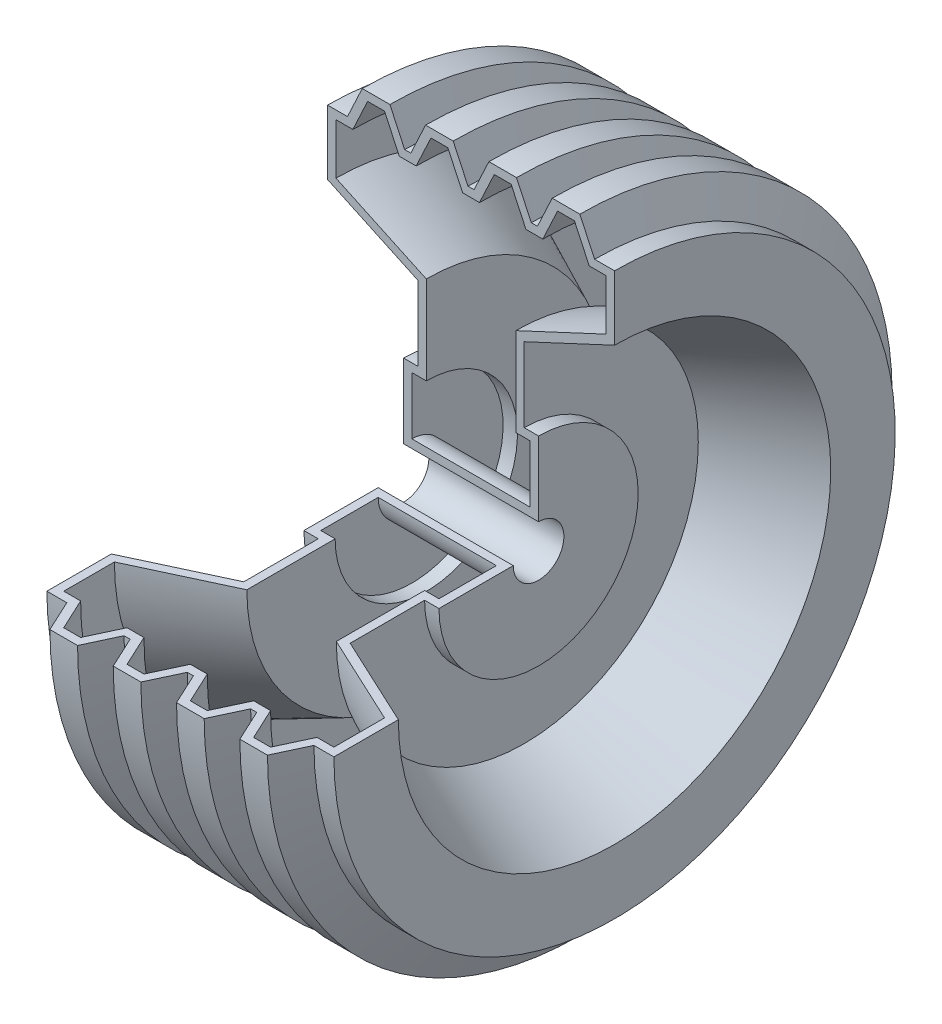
SolidWorks part; units mm, degrees
ref_plane "Front Plane" through (0, 0, 0) normal (0, 0, 1) x (1, 0, 0)
ref_plane "Top Plane" through (0, 0, 0) normal (0, 1, 0) x (1, 0, 0)
ref_plane "Right Plane" through (0, 0, 0) normal (1, 0, 0) x (0, 0, -1)
sketch "Sketch1" plane through (0, 0, 0) normal (0, 0, 1) x (1, 0, 0)
  line L0 (-70.7632, 0) -> (73.6515, 0) construction
  line L1 (0, -14.8025) -> (0, 284.5396) construction
  line L2 (35, 20) -> (-35, 20)
  line L3 (-35, 20) -> (-35, 54)
  line L4 (35, 20) -> (35, 54)
  line L5 (-35, 54) -> (-26.5, 54)
  line L6 (35, 54) -> (26.5, 54)
  line L7 (-26.5, 54) -> (-26.5, 106.2881)
  line L8 (26.5, 54) -> (26.5, 106.2881)
  line L9 (-26.5, 106.2881) -> (-80, 131.2356)
  line L10 (26.5, 106.2881) -> (80, 131.2356)
  line L11 (-80, 131.2356) -> (-80, 161.2356)
  line L12 (80, 131.2356) -> (80, 161.2356)
  line L13 (-80, 161.2356) -> (-70, 161.2356)
  line L14 (80, 161.2356) -> (70, 161.2356)
  line L15 (-70, 161.2356) -> (-61.25, 180)
  line L16 (70, 161.2356) -> (61.25, 180)
  line L17 (-61.25, 180) -> (-51.25, 180)
  line L18 (61.25, 180) -> (51.25, 180)
  line L19 (-51.25, 180) -> (-42.5, 161.2356)
  line L20 (51.25, 180) -> (42.5, 161.2356)
  line L21 (-42.5, 161.2356) -> (-32.5, 161.2356)
  line L22 (42.5, 161.2356) -> (32.5, 161.2356)
  line L23 (-32.5, 161.2356) -> (-23.75, 180)
  line L24 (32.5, 161.2356) -> (23.75, 180)
  line L25 (-23.75, 180) -> (-13.75, 180)
  line L26 (23.75, 180) -> (13.75, 180)
  line L27 (-13.75, 180) -> (-5, 161.2356)
  line L28 (13.75, 180) -> (5, 161.2356)
  line L29 (-5, 161.2356) -> (5, 161.2356)
  point P8 (0, 20)
  point P34 (0, 161.2356)
  dimension "D1" = 40
  dimension "D2" = 108
  dimension "D3" = 70
  dimension "D4" = 53
  dimension "D5" = 65
  dimension "D6" = 160
  dimension "D7" = 10
  dimension "D8" = 65
  dimension "D9" = 360
  dimension "D10" = 30
revolve "Revolve-Thin1" add sketch "Sketch1" angle 270 about L0
